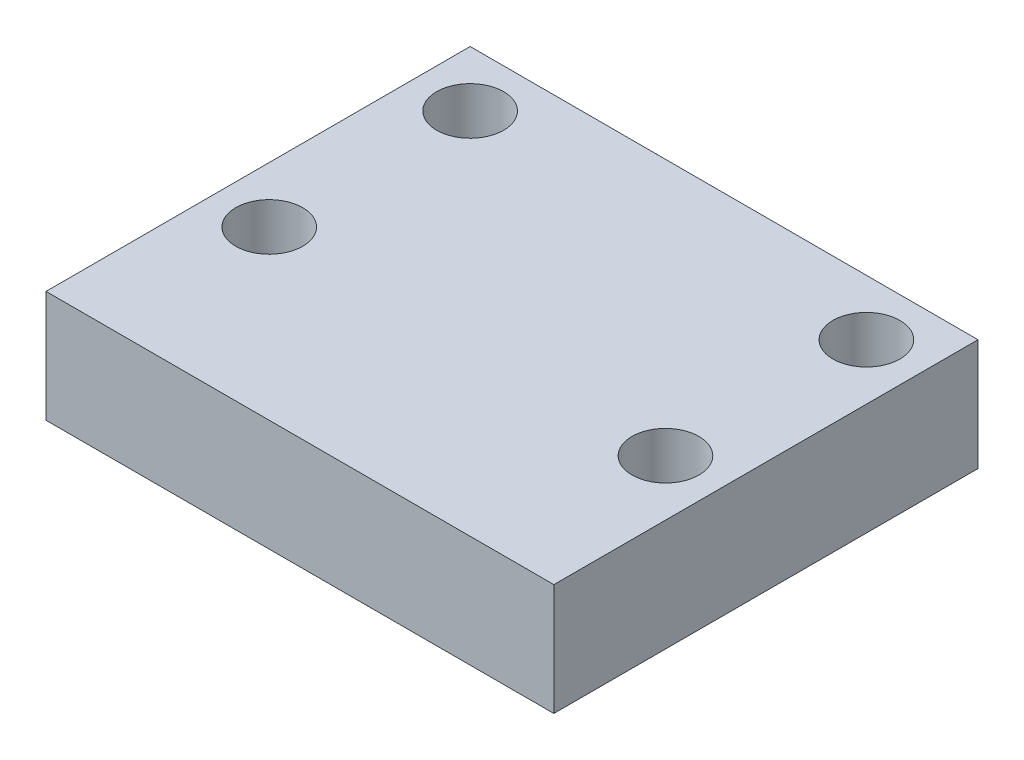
SolidWorks part; units mm, degrees
ref_plane "Front Plane" through (0, 0, 0) normal (0, 0, 1) x (1, 0, 0)
ref_plane "Top Plane" through (0, 0, 0) normal (0, 1, 0) x (1, 0, 0)
ref_plane "Right Plane" through (0, 0, 0) normal (1, 0, 0) x (0, 0, -1)
sketch "Sketch1" plane through (0, 0, 0) normal (0, 1, 0) x (1, 0, 0)
  line L0 (-22.75, 19) -> (22.75, 19)
  line L1 (-22.75, 19) -> (-22.75, -19)
  line L2 (-22.75, -19) -> (22.75, -19)
  line L3 (22.75, 19) -> (22.75, -19)
  line L4 (22.75, 19) -> (16.5851, 19)
  line L5 (-17.75, 14) -> (-17.75, -4) construction
  line L6 (-17.75, -4) -> (17.75, -4) construction
  line L7 (17.75, -4) -> (17.75, 14) construction
  line L8 (17.75, 14) -> (-17.75, 14) construction
  line L9 (0, 19) -> (0, -19) construction
  line L10 (-22.75, 0) -> (22.75, 0) construction
  circle A0 centre (-17.75, 14) radius 2
  circle A1 centre (-17.75, -4) radius 2
  circle A2 centre (17.75, 14) radius 2
  circle A3 centre (17.75, -4) radius 2
  point P13 (0, 0)
  point P18 (0, 0)
  point P20 (-17.75, -4)
  point P21 (22.75, 0)
  point P22 (0, 0)
  dimension "D3" = 4
  dimension "D5" = 4
  dimension "D6" = 4
  dimension "D7" = 4
  dimension "D1" = 45.5
  dimension "D2" = 38
  dimension "D4" = 18
  dimension "D8" = 35.5
  dimension "D9" = 5
  dimension "D10" = 5
extrude "Boss-Extrude1" add sketch "Sketch1" along normal blind 10 contours L3 L2 L1 L0 | A1 | A0 | A3 | A2
sketch "Sketch2" plane through (0, 0, 0) normal (0, -1, 0) x (1, 0, 0)
  line L0 (0, 19) -> (0, -19) construction
  line L1 (-22.75, 19) -> (22.75, 19) construction
  line L2 (-22.75, -19) -> (22.75, -19) construction
  circle A0 centre (-17.75, 4) radius 3
  circle A1 centre (-17.75, -14) radius 3
  circle A2 centre (17.75, -14) radius 3
  circle A3 centre (17.75, 4) radius 3
  dimension "D1" = 6
  dimension "D2" = 6
extrude "Cut-Extrude1" cut sketch "Sketch2" against normal through all
